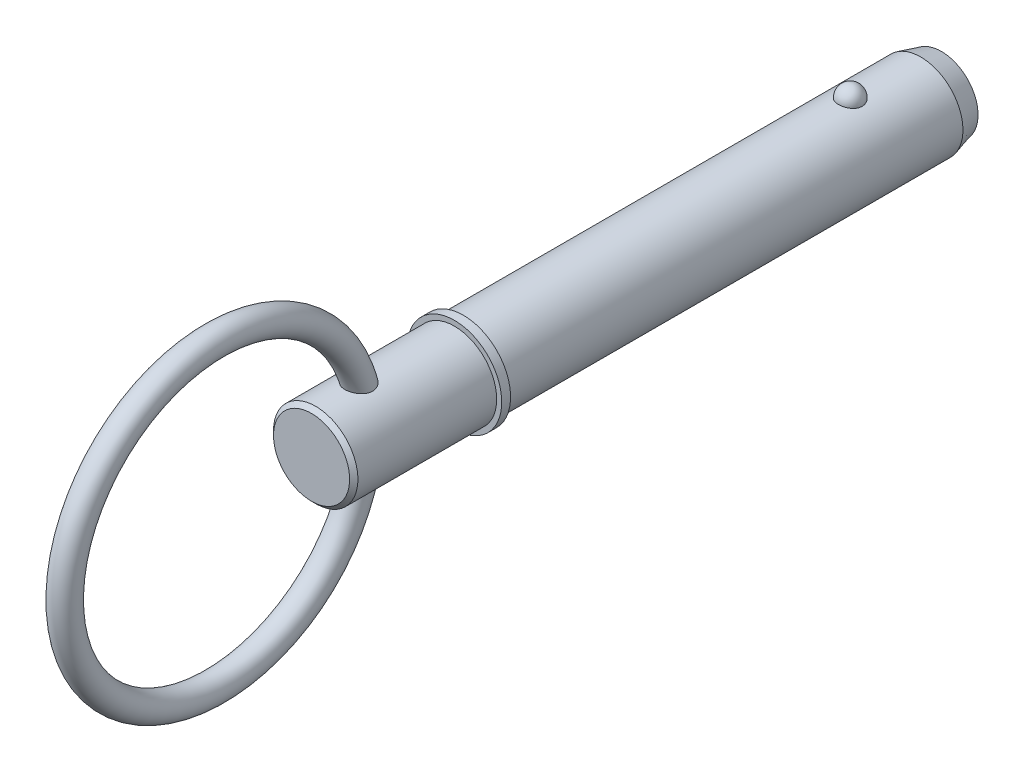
SolidWorks part; units mm, degrees
ref_plane "Front Plane" through (0, 0, 0) normal (0, 0, 1) x (1, 0, 0)
ref_plane "Top Plane" through (0, 0, 0) normal (0, 1, 0) x (1, 0, 0)
ref_plane "Right Plane" through (0, 0, 0) normal (1, 0, 0) x (0, 0, -1)
sketch "Sketch2" plane through (0, 0, 0) normal (0, 0, 1) x (1, 0, 0)
  circle A0 centre (0, 0) radius 7.145
  point P3 (0, 7.145)
  dimension "D1" = 14.29
extrude "Boss-Extrude1" add sketch "Sketch2" along normal blind 63.5
sketch "Sketch3" plane through (0, 0, 0) normal (0, 0, -1) x (-1, 0, 0)
  circle A0 centre (0, 0) radius 7.145
  dimension "D1" = 14.29
extrude "Boss-Extrude2" add sketch "Sketch3" along normal blind 17.45
chamfer "Chamfer1" distance 3.5 angle 15 1 edges at (-7.145, 0, -17.45)
sketch "Sketch18" plane through (0, 0, 0) normal (1, 0, 0) x (0, 0, -1)
  line L0 (13.95, 7.145) -> (-63.5, 7.145) construction
  line L1 (2.02, 9.165) -> (2.02, 5.125)
  line L2 (-63.5, -7.145) -> (13.95, -7.145) construction
  arc A0 (2.02, 9.165) -> (2.02, 5.125) centre (2.02, 7.145) ccw
  point P4 (0, 7.145)
  dimension "D1" = 16.31
revolve "Revolve1" add sketch "Sketch18" angle 360 about L1
sketch "Sketch19" plane through (0, 0, 0) normal (1, 0, 0) x (0, 0, -1)
  line L0 (-33.7288, 0) -> (-46.4542, 0) construction
sketch "Sketch20" plane through (0, 0, 0) normal (1, 0, 0) x (0, 0, -1)
  line L0 (-63.5, 0) -> (-63.5, 8)
  line L1 (-63.5, 7.145) -> (-63.5, -7.145) construction
  line L2 (-63.5, 8) -> (-65, 8)
  line L3 (-65, 8) -> (-65, 0)
  line L4 (-33.7288, 0) -> (-46.4542, 0) construction
  line L5 (-65, 0) -> (-63.5, 0)
  dimension "D1" = 8
  dimension "D2" = 1.5
revolve "Revolve2" add sketch "Sketch20" angle 360 about L0
sketch "Sketch21" plane through (0, 0, 63.5) normal (0, 0, -1) x (-1, 0, 0)
  circle A0 centre (0, 0) radius 7.145
  dimension "D1" = 14.29
extrude "Boss-Extrude3" add sketch "Sketch21" against normal blind 25.7
chamfer "Chamfer2" distance 0.7 angle 45 1 edges at (-7.145, 0, 89.2)
sketch "Sketch23" plane through (0, 0, 0) normal (1, 0, 0) x (0, 0, -1)
  line L0 (-89.2, 6.445) -> (-89.2, -6.445) construction
  circle A0 centre (-105.6, 0) radius 25.4
  point P2 (-80.2, 0)
  dimension "D1" = 50.8
  dimension "D2" = 9
sketch "Sketch24" plane through (0, 0, 0) normal (0, 1, 0) x (1, 0, 0)
  circle A0 centre (0, -80.2) radius 2.25
  dimension "D1" = 4.5
sweep "Sweep1" add profiles "Sketch24" path "Sketch23"
